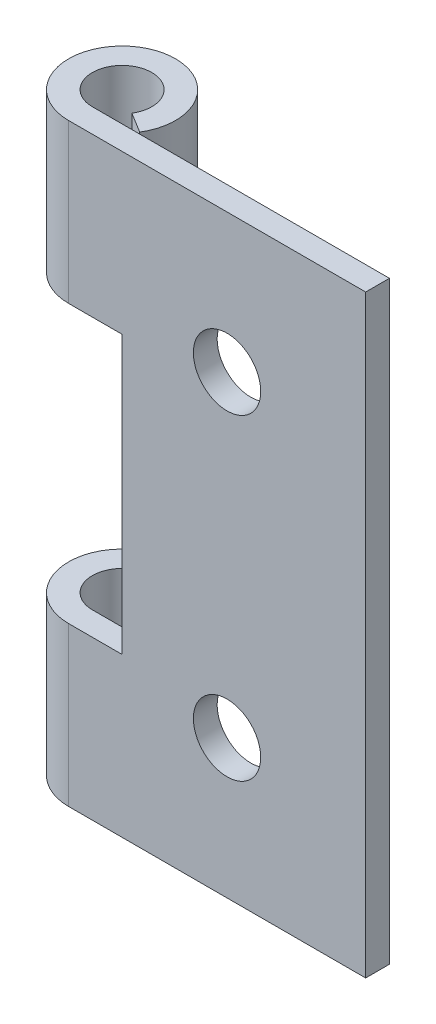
SolidWorks part; units mm, degrees
ref_plane "Ön Düzlem" through (0, 0, 0) normal (0, 0, 1) x (1, 0, 0)
ref_plane "Üst Düzlem" through (0, 0, 0) normal (0, 1, 0) x (1, 0, 0)
ref_plane "Sağ Düzlem" through (0, 0, 0) normal (1, 0, 0) x (0, 0, -1)
sketch "Çizim1" plane through (0, 0, 0) normal (0, 1, 0) x (1, 0, 0)
  line L0 (0, 7.8372) -> (0, -8.9997) construction
  line L1 (0, 0.6) -> (15, 0.6)
  line L3 (0, -0.6) -> (15, -0.6)
  line L4 (15, 0.6) -> (15, -0.6)
  line L5 (0, 0) -> (15, -0.6) construction
  line L6 (0, 0) -> (15, 0.6) construction
  line L7 (2.3018, 0.6888) -> (1.2788, 1.316)
  arc A0 (2.3018, 0.6888) -> (0, -0.6) centre (0, 2.1) ccw
  arc A4 (1.2788, 1.316) -> (0, 0.6) centre (0, 2.1) ccw
  point P0 (0, 0)
  dimension "D1" = 2.7
  dimension "D2" = 1.2
extrude "Yükseklik-Ekstrüzyon1" add sketch "Çizim1" against normal blind 30
sketch "Çizim3" plane through (0, -30, 0) normal (0, -1, 0) x (1, 0, 0)
  line L0 (1.2788, -1.316) -> (2.3018, -0.6888) construction
  line L1 (1.2788, -1.316) -> (2.3018, -0.6888)
  line L3 (0, -0.6) -> (2.7, -0.6)
  line L4 (2.7, -0.6) -> (2.7, 0.6)
  line L5 (0, 0.6) -> (15, 0.6) construction
  line L6 (15, -0.6) -> (0, -0.6) construction
  line L7 (0, 0.6) -> (2.7, 0.6)
  arc A0 (0, -0.6) -> (1.2788, -1.316) centre (0, -2.1) ccw construction
  arc A1 (0, 0.6) -> (2.3018, -0.6888) centre (0, -2.1) ccw construction
  arc A2 (0, -0.6) -> (1.2788, -1.316) centre (0, -2.1) ccw
  arc A3 (0, 0.6) -> (2.3018, -0.6888) centre (0, -2.1) ccw
extrude "Kes-Ekstrüzyon2" cut sketch "Çizim3" against normal blind 14 from offset 8
sketch "Çizim4" plane through (0, 0, -0.6) normal (0, 0, -1) x (-1, 0, 0)
  line L0 (0, -30) -> (0, 0) construction
  line L1 (-2.7, -30) -> (2.7, -30) construction
  line L2 (-15, 0) -> (0, 0) construction
  circle A0 centre (-8, -23) radius 1.7
  circle A1 centre (-8, -7) radius 1.7
  dimension "D4" = 3.4
  dimension "D5" = 3.4
  dimension "D1" = 8
  dimension "D2" = 16
  dimension "D3" = 7
extrude "Kes-Ekstrüzyon3" cut sketch "Çizim4" against normal blind 1.2
